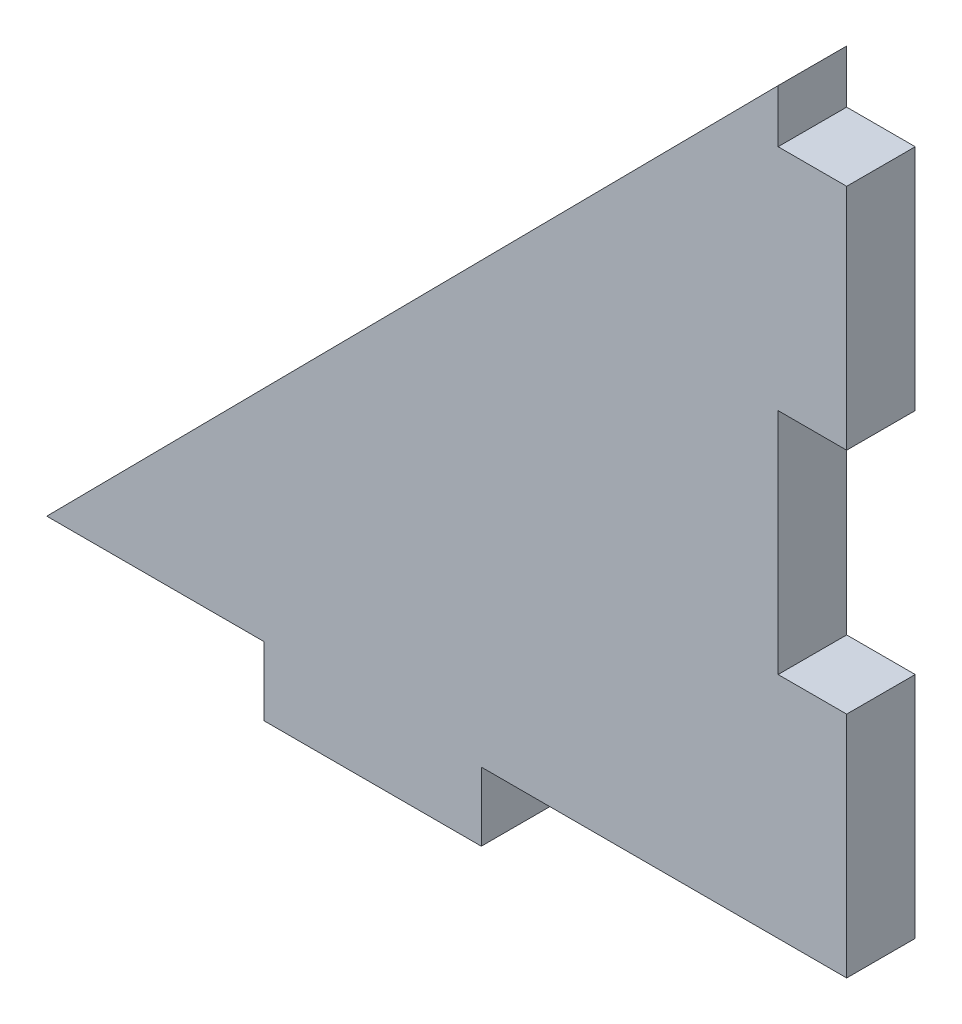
SolidWorks part; units mm, degrees
ref_plane "Plan de face" through (0, 0, 0) normal (0, 0, 1) x (1, 0, 0)
ref_plane "Plan de dessus" through (0, 0, 0) normal (0, 1, 0) x (1, 0, 0)
ref_plane "Plan de droite" through (0, 0, 0) normal (1, 0, 0) x (0, 0, -1)
sketch "Esquisse1" plane through (0, 0, 0) normal (0, 0, 1) x (1, 0, 0)
  line L1 (0, 5) -> (0, 185) construction
  line L3 (0, 8) -> (-100, 8) construction
  line L4 (-32, 8) -> (-22.4928, 8)
  line L5 (-22.4928, 8) -> (-22.4928, 5)
  line L6 (0, 5) -> (-100, 5) construction
  line L7 (-22.4928, 5) -> (-12.986, 5)
  line L8 (-12.986, 5) -> (-12.986, 8)
  line L9 (-12.986, 8) -> (0, 8)
  line L10 (0, 8) -> (3, 8)
  line L11 (3, 8) -> (3, 18)
  line L12 (3, 18) -> (0, 18)
  line L13 (0, 18) -> (0, 28)
  line L14 (0, 28) -> (3, 28)
  line L15 (3, 28) -> (3, 38)
  line L16 (3, 38) -> (0, 38)
  line L17 (0, 38) -> (0, 40.3164)
  line L19 (0, 40.3164) -> (-32, 8)
  dimension "D1" = 35
extrude "Boss.-Extru.1" add sketch "Esquisse1" along normal blind 3 contours L4 L5 L7 L8 L9 L10 L11 L12 L13 L14 L15 L16 L17 L19
